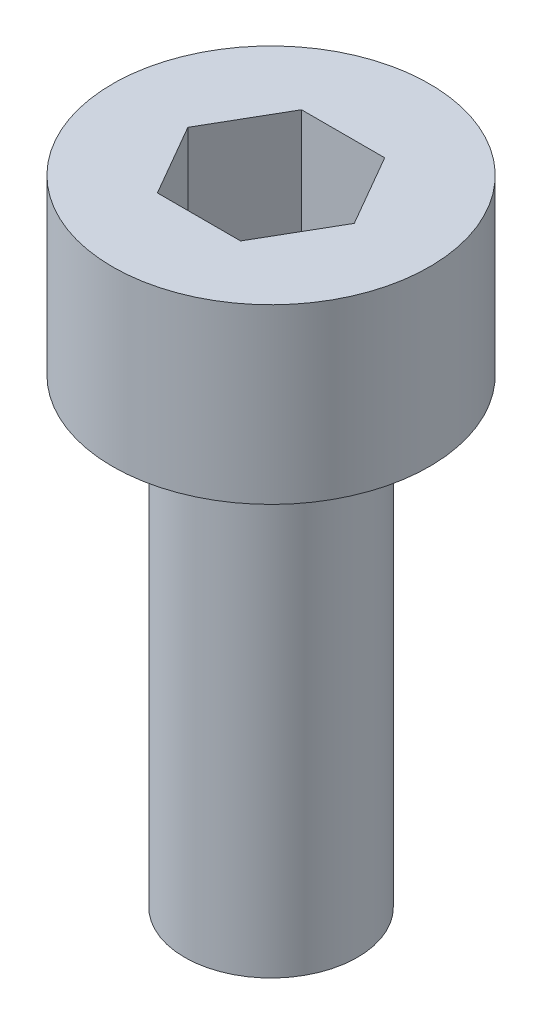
SolidWorks part; units mm, degrees
ref_plane "Front" through (0, 0, 0) normal (0, 0, 1) x (1, 0, 0)
ref_plane "Top" through (0, 0, 0) normal (0, 1, 0) x (1, 0, 0)
ref_plane "Right" through (0, 0, 0) normal (1, 0, 0) x (0, 0, -1)
sketch "profiile" plane through (0, 0, 0) normal (0, 0, 1) x (1, 0, 0)
  line L0 (0, 9.9072) -> (0, -20.7151) construction
  line L1 (0, 3) -> (2.75, 3)
  line L2 (2.75, 3) -> (2.75, 0)
  line L3 (2.75, 0) -> (1.5, 0)
  line L4 (1.5, 0) -> (1.5, -8)
  line L5 (1.5, -8) -> (0, -8)
  line L6 (0, -8) -> (0, 3)
  dimension "D1" = 5.5
  dimension "D2" = 3
  dimension "thread_length" = 8
  dimension "D4" = 3
revolve "Base-Revolve" add sketch "profiile" angle 360 about L0
sketch "Sketch1" plane through (0, 3, 0) normal (0, 1, 0) x (1, 0, 0)
  line L1 (1.4434, 0) -> (0.7217, 1.25)
  line L2 (0.7217, 1.25) -> (-0.7217, 1.25)
  line L3 (-0.7217, 1.25) -> (-1.4434, 0)
  line L4 (-1.4434, 0) -> (-0.7217, -1.25)
  line L5 (-0.7217, -1.25) -> (0.7217, -1.25)
  line L6 (0.7217, -1.25) -> (1.4434, 0)
  circle A0 centre (0, 0) radius 1.25 construction
  dimension "D1" = 2.5
extrude "Cut-Extrude1" cut sketch "Sketch1" against normal blind 2.5
